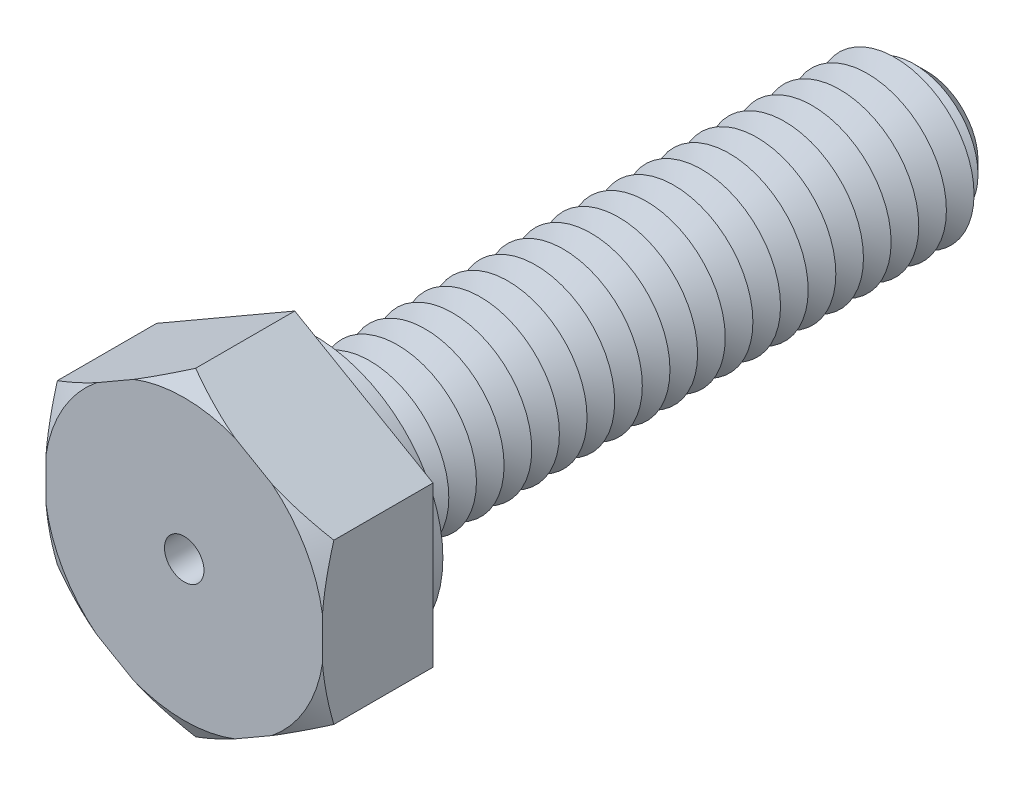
SolidWorks part; units mm, degrees
ref_plane "Front Plane" through (0, 0, 0) normal (0, 0, 1) x (1, 0, 0)
ref_plane "Top Plane" through (0, 0, 0) normal (0, 1, 0) x (1, 0, 0)
ref_plane "Right Plane" through (0, 0, 0) normal (1, 0, 0) x (0, 0, -1)
sketch "Sketch2" plane through (0, 0, 0) normal (0, 0, 1) x (1, 0, 0)
  line L1 (0, 4.0415) -> (-3.5, 2.0207)
  line L2 (-3.5, 2.0207) -> (-3.5, -2.0207)
  line L3 (-3.5, -2.0207) -> (0, -4.0415)
  line L4 (0, -4.0415) -> (3.5, -2.0207)
  line L5 (3.5, -2.0207) -> (3.5, 2.0207)
  line L6 (3.5, 2.0207) -> (0, 4.0415)
  circle A0 centre (0, 0) radius 3.5 construction
  dimension "D1" = 7
extrude "Boss-Extrude1" add sketch "Sketch2" along normal blind 2.8
sketch "Sketch3" plane through (0, 0, 0) normal (0, 0, -1) x (-1, 0, 0)
  circle A0 centre (0, 0) radius 2
  dimension "D1" = 4
extrude "Boss-Extrude2" add sketch "Sketch3" along normal blind 16
sketch "Sketch4" plane through (0, 0, 0) normal (0, 0, -1) x (-1, 0, 0)
  circle A0 centre (0, 0) radius 3.25
  dimension "D1" = 6.5
extrude "Boss-Extrude3" add sketch "Sketch4" along normal blind 0.5
sketch "Sketch5" plane through (0, 0, 0) normal (1, 0, 0) x (0, 0, -1)
  line L0 (-3.2117, 0) -> (6.3192, 0) construction
chamfer "Chamfer1" distance 0.7 angle 45 1 edges at (-2, 0, -16)
sketch "Sketch6" plane through (0, 0, 0) normal (1, 0, 0) x (0, 0, -1)
  line L0 (0.5, 2) -> (0.85, 1.3938)
  line L1 (0.85, 1.3938) -> (1.2, 2)
  line L2 (15.3, 2) -> (0.5, 2) construction
  line L3 (1.2, 2) -> (0.5, 2)
  dimension "D1" = 0.7
revolve "Cut-Revolve1" cut sketch "Sketch6" angle 360 about L0
pattern_linear "LPattern1" count 22 spacing 0.7 along (0, 0, -1) of "Cut-Revolve1"
sketch "Sketch7" plane through (0, 0, 0) normal (1, 0, 0) x (0, 0, -1)
  line L0 (-2.8, 4.0415) -> (-2.8, 3.5415)
  line L1 (-2.8, 2.0207) -> (-2.8, 4.0415) construction
  line L2 (-2.8, 3.5415) -> (-2.5113, 4.0415)
  line L3 (-2.8, 4.0415) -> (0, 4.0415) construction
  line L4 (-2.5113, 4.0415) -> (-2.8, 4.0415)
  dimension "D1" = 0.5
  dimension "D2" = 30
revolve "Cut-Revolve2" cut sketch "Sketch7" angle 360 about L0
sketch "Sketch8" plane through (0, 0, 2.8) normal (0, 0, 1) x (1, 0, 0)
  circle A0 centre (0, 0) radius 0.5
  dimension "D1" = 1
extrude "Cut-Extrude1" cut sketch "Sketch8" against normal up to surface (18.8 mm away)
